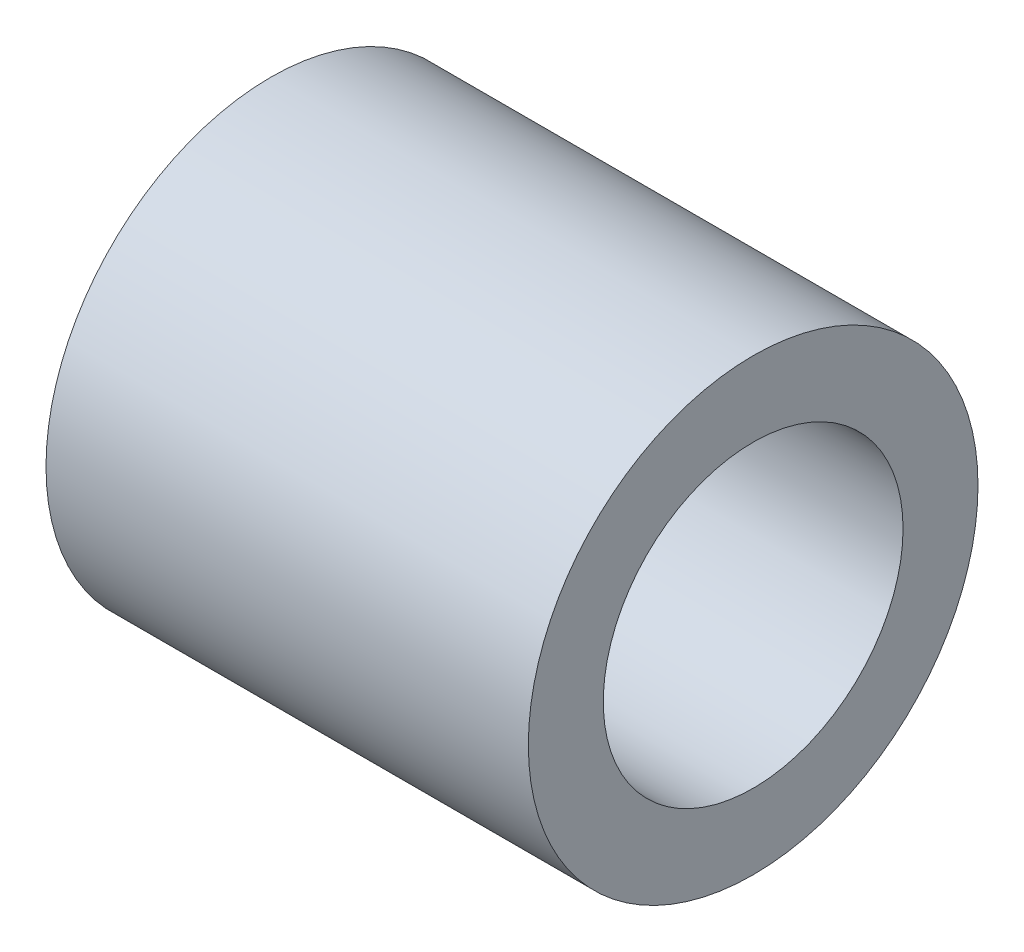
SolidWorks part; units mm, degrees
ref_plane "Front XY" through (0, 0, 0) normal (0, 0, 1) x (1, 0, 0)
ref_plane "Top XZ" through (0, 0, 0) normal (0, 1, 0) x (1, 0, 0)
ref_plane "Right YZ" through (0, 0, 0) normal (1, 0, 0) x (0, 0, -1)
sketch "Sketch1" plane through (0, 0, 0) normal (1, 0, 0) x (0, 0, -1)
  circle A0 centre (0, 0) radius 38.1
  dimension "D1" = 76.2
extrude "Extrude-Thin1" add sketch "Sketch1" along normal mid plane 81.7372 thin
